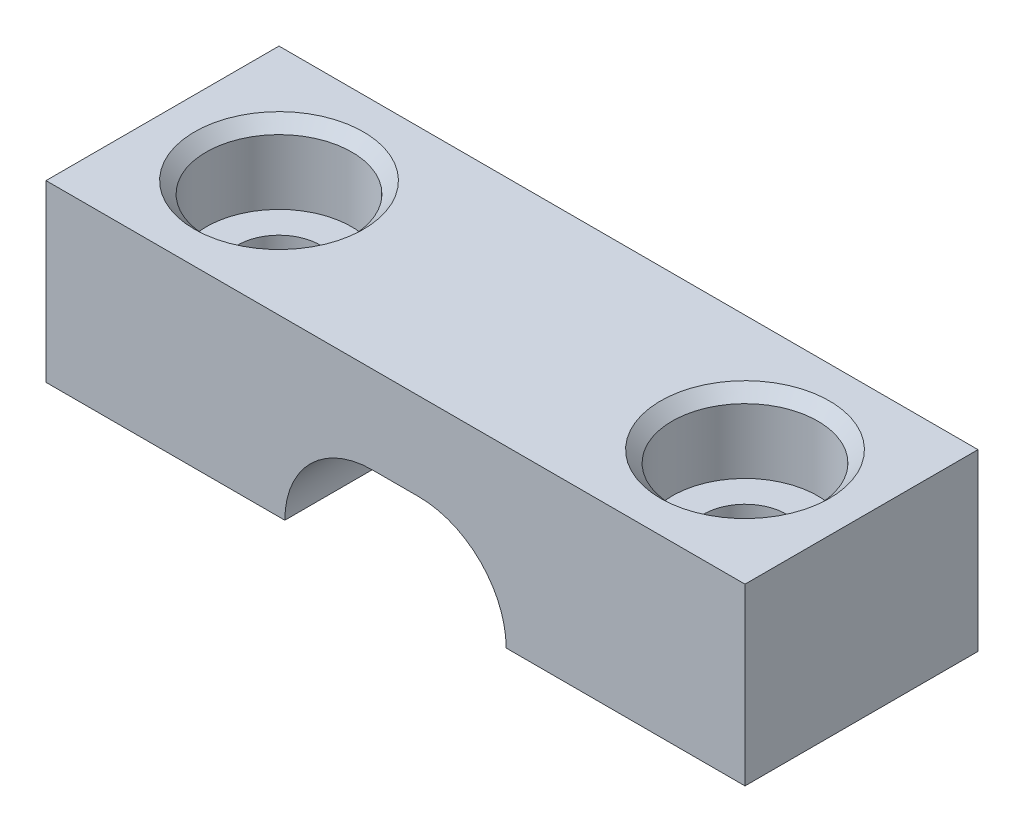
SolidWorks part; units mm, degrees
ref_plane "Front Plane" through (0, 0, 0) normal (0, 0, 1) x (1, 0, 0)
ref_plane "Top Plane" through (0, 0, 0) normal (0, 1, 0) x (1, 0, 0)
ref_plane "Right Plane" through (0, 0, 0) normal (1, 0, 0) x (0, 0, -1)
sketch "Sketch1" plane through (0, 0, 0) normal (0, 0, 1) x (1, 0, 0)
  line L0 (25.0825, 0) -> (38.1, 0)
  line L1 (0, 0) -> (13.0175, 0)
  line L2 (0, 0) -> (0, 9.525)
  line L3 (0, 9.525) -> (38.1, 9.525)
  line L4 (38.1, 0) -> (38.1, 9.525)
  line L5 (17.78, 4.7625) -> (20.32, 4.7625)
  arc A0 (13.0175, 0) -> (17.78, 4.7625) centre (17.78, 0) cw
  arc A1 (25.0825, 0) -> (20.32, 4.7625) centre (20.32, 0) ccw
  point P11 (19.05, 4.7625)
  dimension "D2" = 4.7625
  dimension "D4" = 4.7625
  dimension "D1" = 9.525
  dimension "D3" = 38.1
  dimension "D5" = 2.54
  dimension "D6" = 19.05
  dimension "D7" = 90
  dimension "D8" = 90
extrude "Extrude1" add sketch "Sketch1" along normal blind 12.7
hole_wizard "CBORE for #8 Socket Head Cap Screw1" positions "3DSketch1" profile "Sketch2" counterbore size "#8" standard "Ansi Inch"
sketch3d "3DSketch1"
  line L0 (0, 9.525, 6.35) -> (38.1, 9.525, 6.35) construction
  line L1 (0, 9.525, 12.7) -> (0, 9.525, 0) construction
  line L2 (38.1, 9.525, 12.7) -> (38.1, 9.525, 0) construction
  point P0 (6.35, 9.525, 6.35)
  point P2 (31.75, 9.525, 6.35)
  dimension "D1" = 6.35
  dimension "D2" = 25.4
sketch "Sketch2" plane through (6.35, 9.525, 6.35) normal (1, 0, 0) x (0, 0, 1)
  line L0 (0, 0) -> (0, 9.525)
  line L1 (0, 9.525) -> (2.2479, 9.525)
  line L3 (2.2479, 9.525) -> (2.2479, 4.1656)
  line L4 (3.9687, 4.1656) -> (2.2479, 4.1656)
  line L5 (3.9687, 4.1656) -> (3.9687, 0.635)
  line L6 (3.9687, 0.635) -> (4.6037, 0)
  line L7 (4.6037, 0) -> (0, 0)
  line L8 (-3.9687, 0.635) -> (-4.6037, 0) construction
  line L11 (0, -6.35) -> (0, 107.95) construction
  dimension "Thru Hole Dia." = 4.4958
  dimension "Thru Hole Depth" = 9.525
  dimension "C'Bore Dia." = 7.9375
  dimension "C'Bore Depth" = 4.1656
  dimension "Near C'Sink Dia." = 9.2075
  dimension "Near C'Sink Angle" = 90
